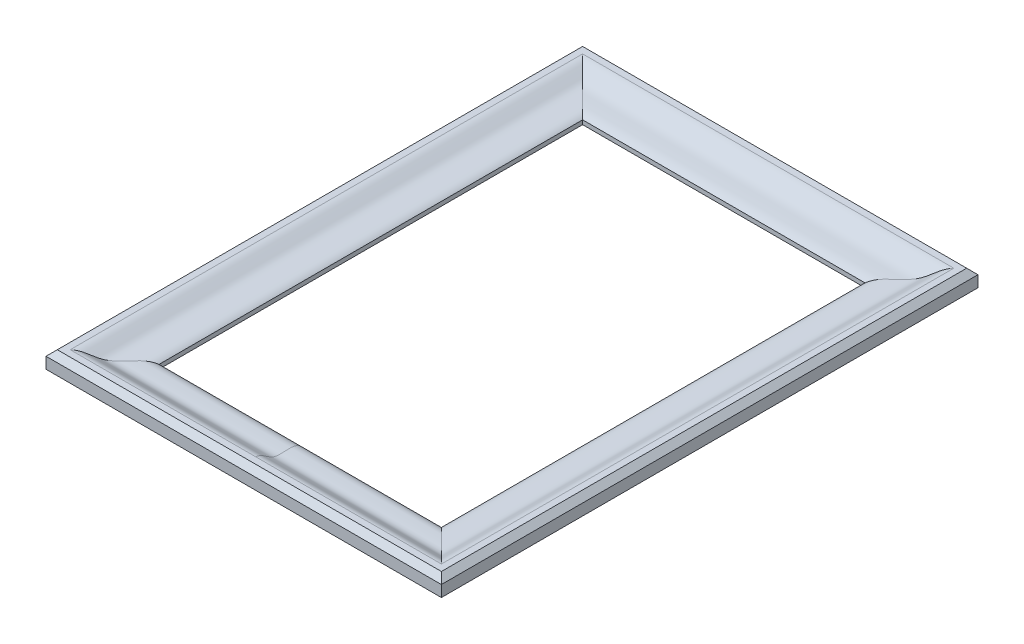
SolidWorks part; units mm, degrees
ref_plane "Спереди" through (0, 0, 0) normal (0, 0, 1) x (1, 0, 0)
ref_plane "Сверху" through (0, 0, 0) normal (0, 1, 0) x (1, 0, 0)
ref_plane "Справа" through (0, 0, 0) normal (1, 0, 0) x (0, 0, -1)
sketch "Sketch1" plane through (0, 0, 0) normal (0, 1, 0) x (1, 0, 0)
  line L1 (-50, 0) -> (50, 0)
  line L2 (-50, 0) -> (-50, 150)
  line L3 (-50, 150) -> (50, 150)
  line L4 (50, 0) -> (50, 150)
  dimension "D1" = 100
  dimension "D2" = 150
sketch "Sketch2" plane through (0, 0, 0) normal (1, 0, 0) x (0, 0, -1)
  line L1 (0, 0) -> (-20, 0)
  line L2 (0, 0) -> (0, 1.494)
  line L3 (-15.714, 6) -> (-20, 6)
  line L4 (-20, 0) -> (-20, 6)
  spline S0 degree 3 poles (-15.714, 6) (-14.1947, 5.9312) (-12.2966, 4.472) (-7.5929, 1.3424) (-2.7639, 3.7326) (0, 1.494) knots 0.019756 0.019756 0.019756 0.019756 0.277587 0.419202 1 1 1 1
  dimension "D1" = 20
  dimension "D2" = 6
sweep "Sweep1" add profiles "Sketch2" path "Sketch1"
chamfer "Chamfer1" distance 2 angle 45 4 edges at (0, 6, 20) (-70, 6, -75) (0, 6, -170) (70, 6, -75)
